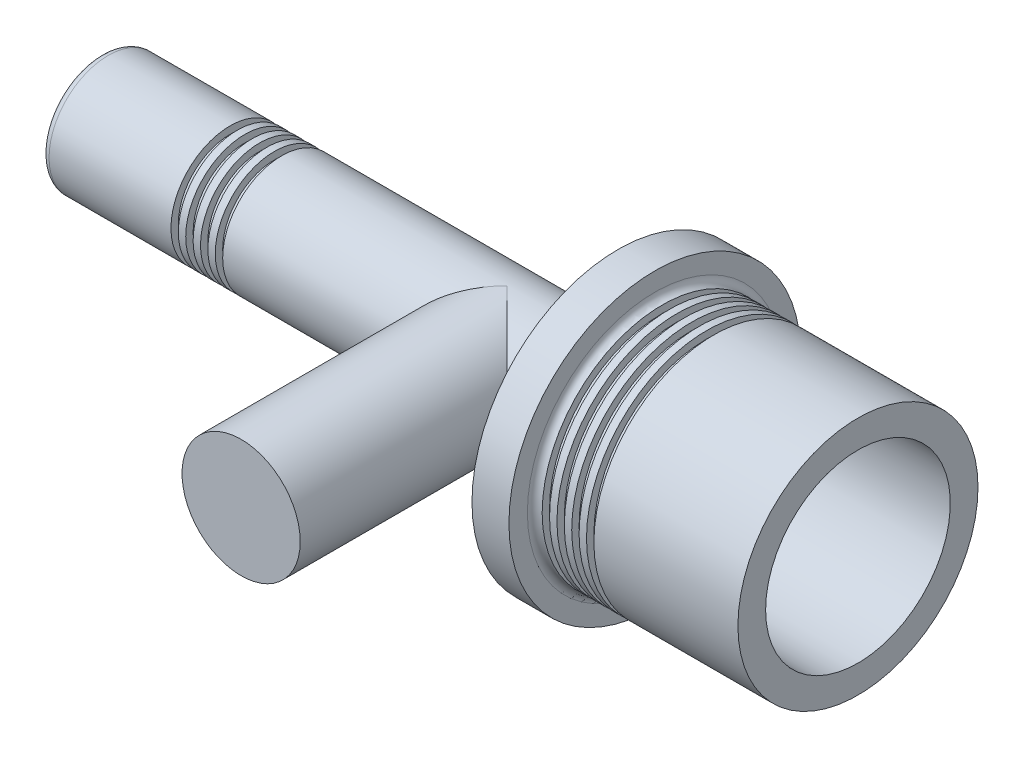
SolidWorks part; units mm, degrees
ref_plane "Vorne" through (0, 0, 0) normal (0, 0, 1) x (1, 0, 0)
ref_plane "Oben" through (0, 0, 0) normal (0, 1, 0) x (1, 0, 0)
ref_plane "Rechts" through (0, 0, 0) normal (1, 0, 0) x (0, 0, -1)
sketch "Skizze1" plane through (0, 0, 0) normal (0, 0, 1) x (1, 0, 0)
  line L0 (0, 0) -> (26.4423, 0) construction
  line L1 (0.0001, 0) -> (0.0001, 1.6)
  line L2 (0.0001, 1.6) -> (3.5001, 1.6)
  line L3 (14.0001, 1.6) -> (14.0001, 3.95)
  line L4 (14.0001, 3.95) -> (15.0001, 3.95)
  line L5 (15.0001, 3.95) -> (15.0001, 3.25)
  line L6 (15.0001, 3.25) -> (15.2001, 3.25)
  line L7 (20.5001, 3.25) -> (20.5001, 2.5)
  line L8 (20.5001, 2.5) -> (15.2001, 2.5)
  line L9 (15.2001, 2.5) -> (15.2001, 0)
  line L10 (3.5001, 1.6) -> (3.5001, 1.4)
  line L11 (3.5001, 1.4) -> (3.7001, 1.4)
  line L12 (3.7001, 1.4) -> (3.7001, 1.6)
  line L13 (3.9001, 1.6) -> (3.9001, 1.4)
  line L14 (3.9001, 1.4) -> (4.1001, 1.4)
  line L15 (4.1001, 1.4) -> (4.1001, 1.6)
  line L16 (3.7001, 1.6) -> (3.9001, 1.6)
  line L17 (4.5001, 1.6) -> (4.7001, 1.6)
  line L18 (4.3001, 1.6) -> (4.3001, 1.4)
  line L19 (4.3001, 1.4) -> (4.5001, 1.4)
  line L20 (4.5001, 1.6) -> (4.5001, 1.4)
  line L21 (4.9001, 1.6) -> (14.0001, 1.6)
  line L22 (4.7001, 1.6) -> (4.7001, 1.4)
  line L23 (4.7001, 1.4) -> (4.9001, 1.4)
  line L24 (4.9001, 1.6) -> (4.9001, 1.4)
  line L25 (4.1001, 1.6) -> (4.3001, 1.6)
  line L26 (15.4001, 3.25) -> (15.6001, 3.25)
  line L27 (15.8001, 3.25) -> (16.0001, 3.25)
  line L28 (15.2001, 3.25) -> (15.2001, 3.05)
  line L29 (15.2001, 3.05) -> (15.4001, 3.05)
  line L30 (15.4001, 3.25) -> (15.4001, 3.05)
  line L31 (16.2001, 3.25) -> (16.4001, 3.25)
  line L32 (15.6001, 3.25) -> (15.6001, 3.05)
  line L33 (15.6001, 3.05) -> (15.8001, 3.05)
  line L34 (15.8001, 3.25) -> (15.8001, 3.05)
  line L35 (0.0001, 0) -> (15.2001, 0)
  line L36 (16.0001, 3.25) -> (16.0001, 3.05)
  line L37 (16.0001, 3.05) -> (16.2001, 3.05)
  line L38 (16.2001, 3.25) -> (16.2001, 3.05)
  line L40 (16.4001, 3.25) -> (16.4001, 3.05)
  line L41 (16.4001, 3.05) -> (16.6001, 3.05)
  line L42 (16.6001, 3.25) -> (16.6001, 3.05)
  line L43 (16.6001, 3.25) -> (20.5001, 3.25)
  dimension "D1" = 3.2
  dimension "D2" = 7.9
  dimension "D3" = 14
  dimension "D4" = 6.5
  dimension "D5" = 6.5
  dimension "D6" = 1
  dimension "D7" = 5
  dimension "D8" = 0.2
  dimension "D9" = 0.2
  dimension "D10" = 0.2
  dimension "D11" = 0.2
  dimension "D12" = 0.2
  dimension "D13" = 0.2
  dimension "D14" = 0.2
  dimension "D15" = 3.5
  dimension "D16" = 0.2
  dimension "D17" = 0.2
  dimension "D18" = 0.2
  dimension "D19" = 0.2
  dimension "D20" = 0.2
  dimension "D21" = 0.2
  dimension "D22" = 0.2
  dimension "D23" = 0.2
  dimension "D24" = 0.2
  dimension "D25" = 0.2
  dimension "D26" = 5.3
  dimension "D27" = 0.2
  dimension "D28" = 0.2
  dimension "D29" = 0.2
  dimension "D30" = 0.2
  dimension "D31" = 0.0001
revolve "Rotation1" add sketch "Skizze1" angle 360 about L0
sketch "Skizze2" plane through (0, 0, 0) normal (0, 0, 1) x (1, 0, 0)
  line L0 (0.0001, 1.6) -> (0.0001, -1.6) construction
  line L1 (11.0001, 0) -> (0, 0) construction
  circle A0 centre (11.0001, 0) radius 1.6
  dimension "D1" = 3.2
  dimension "D2" = 11
extrude "Linear austragen1" add sketch "Skizze2" along normal blind 7.2
fillet "Verrundung2" radius 0.2 2 edges at (15.0001, 0, 3.25) (0.0001, 0, 1.6)
